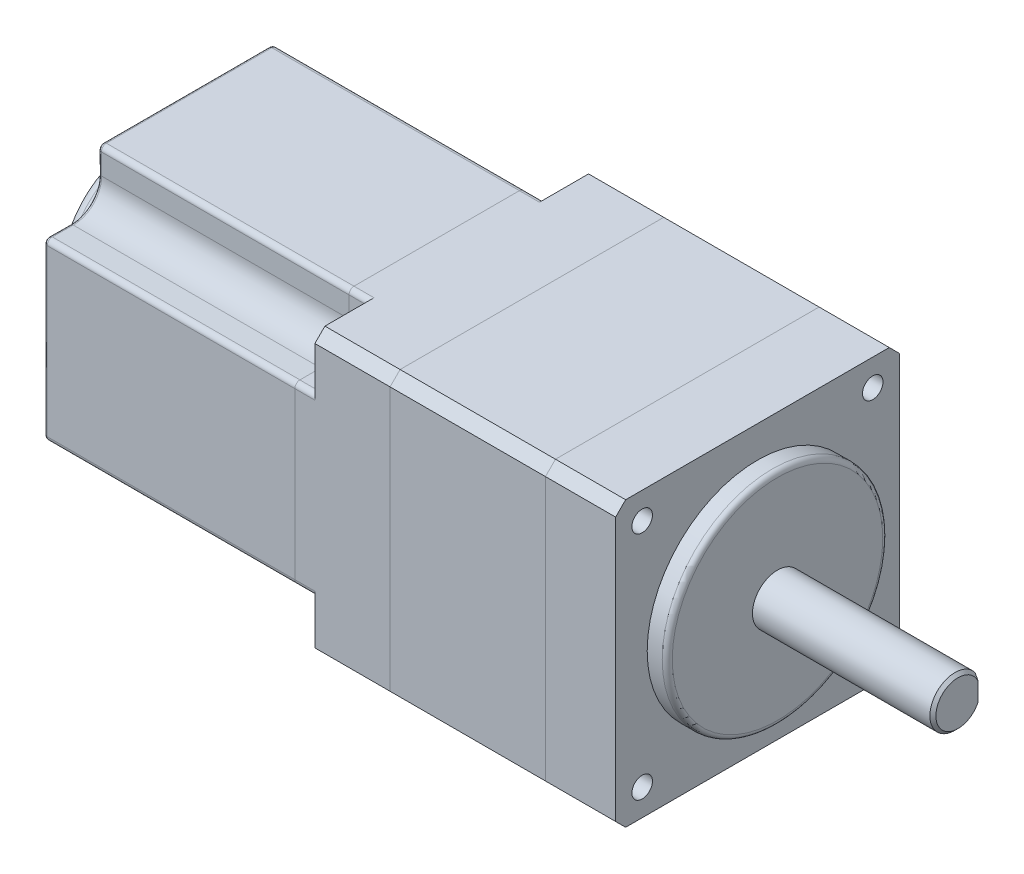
SolidWorks part; units mm, degrees
ref_plane "前视基准面" through (0, 0, 0) normal (0, 0, 1) x (1, 0, 0)
ref_plane "上视基准面" through (0, 0, 0) normal (0, 1, 0) x (1, 0, 0)
ref_plane "右视基准面" through (0, 0, 0) normal (1, 0, 0) x (0, 0, -1)
sketch "草图1" plane through (0, 0, 0) normal (1, 0, 0) x (0, 0, -1)
  line L0 (-14.15, 13.65) -> (-13.65, 14.15)
  line L1 (13.65, 14.15) -> (14.15, 13.65)
  line L2 (14.15, 13.65) -> (14.15, -13.65)
  line L3 (13.65, -14.15) -> (-13.65, -14.15)
  line L4 (-14.15, -13.65) -> (-14.15, 13.65)
  line L5 (-13.65, 14.15) -> (13.65, 14.15)
  line L6 (14.15, -13.65) -> (13.65, -14.15)
  line L7 (-13.65, -14.15) -> (-14.15, -13.65)
  point P4 (14.15, 14.15)
  point P5 (14.15, -14.15)
  point P6 (-14.15, -14.15)
  point P7 (-14.15, 14.15)
extrude "凸台-拉伸1" add sketch "草图1" against normal blind 7
sketch "草图2" plane through (-7, 0, 0) normal (-1, 0, 0) x (0, 0, 1)
  line L0 (-14.15, -13.65) -> (-13.65, -14.15)
  line L2 (13.65, -14.15) -> (14.15, -13.65)
  line L3 (-13.65, -14.15) -> (13.65, -14.15)
  line L4 (14.15, -13.65) -> (14.15, 13.65)
  line L5 (13.65, 14.15) -> (-13.65, 14.15)
  line L6 (-14.15, 13.65) -> (-14.15, -13.65)
  line L7 (14.15, 13.65) -> (13.65, 14.15)
  line L8 (-13.65, 14.15) -> (-14.15, 13.65)
  point P6 (-14.15, -14.15)
  point P7 (14.15, -14.15)
  point P8 (14.15, 14.15)
  point P9 (-14.15, 14.15)
extrude "凸台-拉伸2" add sketch "草图2" along normal blind 15.5 separate body
sketch "草图3" plane through (-22.5, 0, 0) normal (-1, 0, 0) x (0, 0, 1)
  line L0 (-14.15, -13.65) -> (-14.15, 13.65)
  line L2 (-13.65, -14.15) -> (-14.15, -13.65)
  line L3 (-13.65, 14.15) -> (13.65, 14.15)
  line L4 (14.15, 13.65) -> (14.15, -13.65)
  line L5 (13.65, -14.15) -> (-13.65, -14.15)
  line L6 (-14.15, 13.65) -> (-13.65, 14.15)
  line L7 (13.65, 14.15) -> (14.15, 13.65)
  line L8 (14.15, -13.65) -> (13.65, -14.15)
  point P5 (-14.15, 14.15)
  point P7 (14.15, 14.15)
  point P8 (14.15, -14.15)
  point P9 (-14.15, -14.15)
extrude "凸台-拉伸3" add sketch "草图3" along normal blind 9.5 separate body
sketch "草图4" plane through (0, 0, 0) normal (1, 0, 0) x (0, 0, -1)
  circle A0 centre (0, 0) radius 11
extrude "凸台-拉伸4" add sketch "草图4" along normal blind 2
fillet "圆角1" radius 0.5 1 edges at (2, 0, -11)
sketch "草图5" plane through (2, 0, 0) normal (1, 0, 0) x (0, 0, -1)
  circle A0 centre (0, 0) radius 2.5
extrude "凸台-拉伸5" add sketch "草图5" along normal blind 18
chamfer "倒角1" distance 0.3 angle 45 1 edges at (20, 0, -2.5)
sketch "草图7" plane through (20, 0, 0) normal (1, 0, 0) x (0, 0, -1)
  line L2 (2, -1.5) -> (2, 1.5)
  arc A0 (2, -1.5) -> (2, 1.5) centre (0, 0) ccw
extrude "切除-拉伸2" cut sketch "草图7" against normal blind 15
sketch "草图8" plane through (-32, 0, 0) normal (-1, 0, 0) x (0, 0, 1)
  line L0 (-8.75, -11.45) -> (-8.75, -14.15)
  line L1 (-13.65, -14.15) -> (13.65, -14.15) construction
  line L2 (-11.45, -8.75) -> (-14.15, -8.75)
  line L3 (8.75, -11.45) -> (8.75, -14.15)
  line L4 (11.45, -8.75) -> (14.15, -8.75)
  line L5 (14.15, -13.65) -> (14.15, 13.65) construction
  line L6 (-14.15, 13.65) -> (-14.15, -13.65) construction
  line L7 (-11.45, 8.75) -> (-14.15, 8.75)
  line L8 (-8.75, 11.45) -> (-8.75, 14.15)
  line L10 (13.65, 14.15) -> (-13.65, 14.15) construction
  line L11 (11.45, 8.75) -> (14.15, 8.75)
  line L12 (8.75, 11.45) -> (8.75, 14.15)
  line L13 (14.15, -8.75) -> (14.15, -13.65)
  line L14 (14.15, -13.65) -> (13.65, -14.15)
  line L15 (13.65, -14.15) -> (8.75, -14.15)
  line L16 (-8.75, -14.15) -> (-13.65, -14.15)
  line L17 (-13.65, -14.15) -> (-14.15, -13.65)
  line L18 (-14.15, -13.65) -> (-14.15, -8.75)
  line L19 (-14.15, 8.75) -> (-14.15, 13.65)
  line L20 (-14.15, 13.65) -> (-13.65, 14.15)
  line L21 (-13.65, 14.15) -> (-8.75, 14.15)
  line L22 (8.75, 14.15) -> (13.65, 14.15)
  line L23 (13.65, 14.15) -> (14.15, 13.65)
  line L24 (14.15, 13.65) -> (14.15, 8.75)
  arc A0 (11.45, -8.75) -> (8.75, -11.45) centre (11.45, -11.45) ccw
  arc A1 (-8.75, -11.45) -> (-11.45, -8.75) centre (-11.45, -11.45) ccw
  arc A2 (8.75, 11.45) -> (11.45, 8.75) centre (11.45, 11.45) ccw
  arc A3 (-11.45, 8.75) -> (-8.75, 11.45) centre (-11.45, 11.45) ccw
extrude "切除-拉伸3" cut sketch "草图8" against normal blind 2
sketch "草图9" plane through (-32, 0, 0) normal (-1, 0, 0) x (0, 0, 1)
  line L3 (14.15, -8.25) -> (14.15, -8.75)
  line L10 (14.15, -8.75) -> (13.65, -8.75)
  line L14 (8.75, -13.65) -> (8.75, -14.15)
  line L15 (8.75, -14.15) -> (8.25, -14.15)
  line L16 (-8.25, -14.15) -> (-8.75, -14.15)
  line L17 (-8.75, -14.15) -> (-8.75, -13.65)
  line L18 (-13.65, -8.75) -> (-14.15, -8.75)
  line L19 (-14.15, -8.75) -> (-14.15, -8.25)
  line L20 (-14.15, 8.25) -> (-14.15, 8.75)
  line L21 (-14.15, 8.75) -> (-13.65, 8.75)
  line L22 (-8.75, 13.65) -> (-8.75, 14.15)
  line L23 (-8.75, 14.15) -> (-8.25, 14.15)
  line L24 (8.25, 14.15) -> (8.75, 14.15)
  line L25 (8.75, 14.15) -> (8.75, 13.65)
  line L26 (13.65, 8.75) -> (14.15, 8.75)
  line L27 (14.15, 8.75) -> (14.15, 8.25)
  arc A2 (14.15, 8.25) -> (13.65, 8.75) centre (13.65, 8.25) ccw
  arc A3 (8.75, 13.65) -> (8.25, 14.15) centre (8.25, 13.65) ccw
  arc A4 (-8.25, 14.15) -> (-8.75, 13.65) centre (-8.25, 13.65) ccw
  arc A5 (-13.65, 8.75) -> (-14.15, 8.25) centre (-13.65, 8.25) ccw
  arc A6 (-14.15, -8.25) -> (-13.65, -8.75) centre (-13.65, -8.25) ccw
  arc A7 (-8.75, -13.65) -> (-8.25, -14.15) centre (-8.25, -13.65) ccw
  arc A8 (8.25, -14.15) -> (8.75, -13.65) centre (8.25, -13.65) ccw
  arc A9 (14.15, -8.25) -> (13.65, -8.75) centre (13.65, -8.25) cw
  point P37 (14.15, 8.75)
  point P40 (8.75, 14.15)
  point P43 (-8.75, 14.15)
  point P46 (-14.15, 8.75)
  point P49 (-14.15, -8.75)
  point P52 (-8.75, -14.15)
  point P55 (8.75, -14.15)
  point P58 (14.15, -8.75)
  dimension "D1" = 0.5
extrude "切除-拉伸4" cut sketch "草图9" against normal blind 2
sketch "草图10" plane through (-30, 0, 0) normal (-1, 0, 0) x (0, 0, 1)
  circle A0 centre (11.45, -11.45) radius 1.5
sketch "草图11" plane through (-30, 0, 0) normal (-1, 0, 0) x (0, 0, 1)
  circle A0 centre (-11.45, -11.45) radius 1.5
sketch "草图12" plane through (-30, 0, 0) normal (-1, 0, 0) x (0, 0, 1)
  circle A0 centre (-11.45, 11.45) radius 1.5
sketch "草图13" plane through (-30, 0, 0) normal (-1, 0, 0) x (0, 0, 1)
  circle A0 centre (11.45, 11.45) radius 1.3331
extrude "凸台-拉伸12" add sketch "草图13" along normal blind 0.5
extrude "凸台-拉伸13" add sketch "草图10" along normal blind 0.5 contours A0
extrude "凸台-拉伸14" add sketch "草图11" along normal blind 0.5 contours A0
extrude "凸台-拉伸15" add sketch "草图12" along normal blind 0.5 contours A0
fillet "圆角5" radius 0.5 4 edges at (-30.5, -11.45, 12.95) (-30.5, -11.45, -9.95) (-30.5, 11.45, -9.95) (-30.5, 11.45, 12.7831)
sketch "草图15" plane through (0, 0, 14.15) normal (0, 0, 1) x (1, 0, 0)
  line L0 (-32, -8.25) -> (-32, 8.25)
  line L1 (-32, 8.25) -> (-46, 8.25)
  line L2 (-46, 8.25) -> (-46, -8.25)
  line L3 (-46, -8.25) -> (-32, -8.25)
  line L4 (-32, -8.25) -> (-50.8992, -8.3692)
extrude "凸台-拉伸17" add sketch "草图15" along normal blind 3.5 separate body contours L3 L2 L1 M8 M1 M2
sketch "草图17" plane through (0, 0, 0) normal (1, 0, 0) x (0, 0, -1)
  point P1 (11.5, -11.5)
  point P7 (-11.5, -11.5)
  point P9 (-11.5, 11.5)
  point P10 (11.5, 11.5)
hole_wizard "M2.5 螺纹孔1" positions "3D草图1" profile "草图18" tap size "M2.5" standard "GB"
sketch3d "3D草图1"
  point P0 (0, -11.5, -11.5)
  point P3 (0, -11.5, 11.5)
  point P6 (0, 11.5, 11.5)
  point P9 (0, 11.5, -11.5)
sketch "草图18" plane through (0, -11.5, -11.5) normal (0, 1, 0) x (0, 0, -1)
  line L0 (0, 0) -> (0, 3.1159)
  line L1 (0, 3.1159) -> (1.025, 2.5)
  line L2 (1.025, 2.5) -> (1.025, 0)
  line L5 (1.025, 0) -> (0, 0)
  line L10 (0, 3.1159) -> (-1.025, 2.5) construction
  line L11 (0, -6.35) -> (0, 107.95) construction
  dimension "螺纹孔钻头直径" = 2.05
  dimension "螺纹孔钻头深度" = 2.5
  dimension "导头角度" = 118
sketch "草图19" plane through (0, 0, 0) normal (1, 0, 0) x (0, 0, -1)
  line L0 (13.65, -14.15) -> (13.15, -14.15)
  line L1 (-13.65, -14.15) -> (13.65, -14.15) construction
  line L2 (14.15, -13.65) -> (14.15, -13.15)
  line L3 (14.15, -13.65) -> (14.15, 13.65) construction
  line L4 (14.15, 13.65) -> (14.15, 13.15)
  line L5 (13.65, 14.15) -> (13.15, 14.15)
  line L6 (13.65, 14.15) -> (-13.65, 14.15) construction
  line L7 (-13.65, 14.15) -> (-13.15, 14.15)
  line L8 (-14.15, 13.65) -> (-14.15, 13.15)
  line L9 (-14.15, 13.65) -> (-14.15, -13.65) construction
  line L10 (-14.15, -13.65) -> (-14.15, -13.15)
  line L11 (-14.15, -13.65) -> (-13.65, -14.15)
  line L12 (-13.65, -14.15) -> (-13.15, -14.15)
  line L13 (-13.15, -14.15) -> (-14.15, -13.15)
  line L14 (14.15, -13.65) -> (13.65, -14.15)
  line L15 (13.15, -14.15) -> (14.15, -13.15)
  line L16 (14.15, 13.15) -> (13.15, 14.15)
  line L17 (14.15, 13.65) -> (13.65, 14.15)
  line L18 (-13.15, 14.15) -> (-14.15, 13.15)
  line L19 (-14.15, 13.65) -> (-13.65, 14.15)
extrude "切除-拉伸6" cut sketch "草图19" against normal blind 49
sketch "草图20" plane through (-32, 0, 0) normal (-1, 0, 0) x (0, 0, 1)
  line L1 (8.7298, -11.5534) -> (8.75, -13.65)
  line L2 (-14.15, -8.25) -> (-14.15, 8.25)
  line L3 (-8.75, 13.65) -> (-8.75, 11.8381)
  line L4 (14.15, -8.25) -> (14.15, 8.25)
  line L5 (8.75, -13.65) -> (8.7477, -13.6738)
  line L6 (-11.5534, 8.7298) -> (-13.6404, 8.7499)
  line L7 (-13.6404, -8.7499) -> (-11.5559, -8.7316)
  line L8 (8.7298, 11.5534) -> (8.75, 13.65)
  line L9 (-11.5559, -8.7316) -> (-11.5947, -8.6948)
  line L10 (11.5534, 8.7298) -> (13.6404, 8.7499)
  line L11 (-8.25, -14.15) -> (8.25, -14.15)
  line L12 (-8.25, 14.15) -> (8.25, 14.15)
  line L13 (-8.75, -13.65) -> (-8.7483, -11.8087)
  line L15 (11.45, -8.75) -> (13.65, -8.75)
  line L18 (14.15, 8.25) -> (14.15, -8.25)
  line L21 (8.25, 14.15) -> (-8.25, 14.15)
  line L27 (-14.15, 8.25) -> (-14.15, -8.25)
  line L29 (-8.25, -14.15) -> (8.25, -14.15)
  arc A1 (-11.5534, 8.7298) -> (-8.75, 11.8381) centre (-11.5, 11.5) ccw
  arc A2 (11.8381, -8.75) -> (8.7298, -11.5534) centre (11.5, -11.5) ccw
  arc A3 (8.7298, 11.5534) -> (11.5534, 8.7298) centre (11.5, 11.5) ccw
  arc A4 (-13.6404, 8.7499) -> (-14.15, 8.25) centre (-13.65, 8.25) ccw
  arc A5 (-8.25, 14.15) -> (-8.75, 13.65) centre (-8.25, 13.65) ccw
  arc A6 (8.7499, 13.6404) -> (8.25, 14.15) centre (8.25, 13.65) ccw
  arc A7 (14.15, 8.25) -> (13.6404, 8.7499) centre (13.65, 8.25) ccw
  arc A8 (13.65, -8.75) -> (14.15, -8.25) centre (13.65, -8.25) ccw
  arc A9 (8.25, -14.15) -> (8.7499, -13.6404) centre (8.25, -13.65) ccw
  arc A10 (-8.75, -13.6491) -> (-8.25, -14.15) centre (-8.25, -13.65) ccw
  arc A11 (-14.15, -8.25) -> (-13.6404, -8.7499) centre (-13.65, -8.25) ccw
  arc A12 (-8.7483, -11.8087) -> (-11.5559, -8.7316) centre (-11.5, -11.5) ccw
  point P0 (0, 0)
extrude "凸台-拉伸18" add sketch "草图20" along normal blind 25 separate body
fillet "圆角8" radius 0.3 26 edges at (-57, 8.7399, -12.5969) (-57, 8.6069, -14.0001) (-57, 0, -14.15) (-57, -8.6069, -14.0001) (-57, -8.7407, -12.5982) (-57, -10.8746, -8.8026) (-57, -12.7294, -8.7491) (-57, -14.0036, -8.6036) (-57, -14.15, 0) (-57, -14.0036, 8.6036) (-57, -12.6017, 8.7399) (-57, -9.4425, 9.6443) (-57, -8.75, 12.7441) (-57, -8.6036, 14.0036) (-57, -8.834, -10.7519) (-57, 0, 14.15) (-57, 8.6069, 14.0001) (-57, 8.7399, 12.5969) (-57, 9.5408, 9.5408) (-57, 12.6017, 8.7399) (-57, 14.0036, 8.6036) (-57, 14.15, 0) (-57, 14.0036, -8.6036) (-57, -9.5408, -9.5408) (-57, 12.7441, -8.75) (-57, 9.6443, -9.4425)
sketch "草图22" plane through (-57, 0, 0) normal (-1, 0, 0) x (0, 0, 1)
  circle A0 centre (0, 0) radius 8
extrude "凸台-拉伸20" add sketch "草图22" along normal blind 5
fillet "圆角9" radius 1 1 edges at (-62, 0, 8)
sketch "草图24" plane through (-32, 0, 0) normal (-1, 0, 0) x (0, 0, 1)
  line L0 (14.15, 8.25) -> (17.65, 8.25)
  line L1 (17.65, 8.25) -> (17.65, -8.25)
  line L2 (17.65, -8.25) -> (14.15, -8.25)
  line L3 (14.15, -8.25) -> (14.15, 8.25)
extrude "切除-拉伸7" cut sketch "草图24" against normal blind 9.5
sketch "草图25" plane through (-30, 0, 0) normal (-1, 0, 0) x (0, 0, 1)
  line L0 (17.65, 13.65) -> (14.15, 13.65)
  line L2 (17.65, 13.65) -> (17.65, 8.25)
  line L3 (14.15, 13.65) -> (14.15, 8.25)
  line L5 (14.15, 8.25) -> (17.65, 8.25)
  line L6 (14.15, -8.25) -> (17.65, -8.25)
  line L7 (17.65, -8.25) -> (17.65, -13.65)
  line L8 (17.65, -13.65) -> (14.15, -13.65)
  line L9 (14.15, -13.65) -> (14.15, -8.25)
extrude "切除-拉伸8" cut sketch "草图25" against normal blind 7.5
